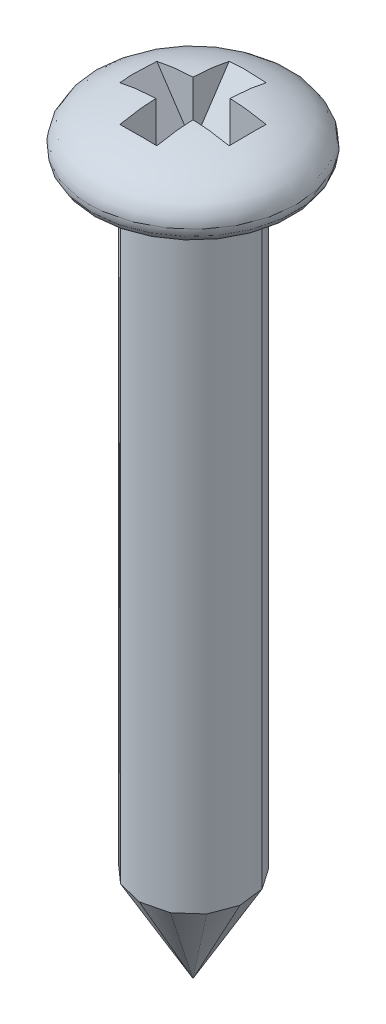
SolidWorks part; units mm, degrees
ref_plane "Plan de face" through (0, 0, 0) normal (0, 0, 1) x (1, 0, 0)
ref_plane "Plan de dessus" through (0, 0, 0) normal (0, 1, 0) x (1, 0, 0)
ref_plane "Plan de droite" through (0, 0, 0) normal (1, 0, 0) x (0, 0, -1)
ref_plane "Plan3" through (0, 6.4, 0) normal (0, 1, 0) x (-1, 0, 0)
sketch "Esquisse1" plane through (0, 6.4, 0) normal (0, 1, 0) x (-1, 0, 0)
  circle A0 centre (0, 0) radius 1.45
extrude "Extrusion1" add sketch "Esquisse1" against normal blind 19
sketch "Esquisse2" plane through (0, 0, 0) normal (0, 0, 1) x (1, 0, 0)
  line L0 (-3.5764, 6.4) -> (3.9855, 6.4) construction
  line L1 (0, 8.9067) -> (0, 4.7448) construction
  line L2 (-2.6992, 8) -> (4.0303, 8) construction
  line L3 (-2.8, 8.6386) -> (-2.8, 5.3938) construction
  line L4 (0, 6.4) -> (-2.3, 6.4)
  line L5 (0, 8) -> (0, 6.4)
  arc A0 (-2.3, 6.4) -> (-2.8, 6.9001) centre (-2.3, 6.9) cw
  spline S0 degree 3 poles (-2.8, 6.9001) (-2.802, 7.3106) (-1.7042, 7.9956) (-0.6729, 7.9983) (0, 8) knots 0 0 0 0 0.347597 1 1 1 1
  point P15 (-2.8, 6.4)
  point P18 (-2.8, 8)
  point P21 (0, 6.4)
  dimension "D1" = 0.5
revolve "Révolution1" add sketch "Esquisse2" angle 360 about L1
sketch "Esquisse3" plane through (0, 0, 0) normal (0, 0, 1) x (1, 0, 0)
  line L0 (0, 9.9885) -> (0, 5.1977) construction
  line L1 (-3.3122, 6.4) -> (4.0377, 6.4) construction
  line L2 (-3.6691, 0) -> (6.2564, 0) construction
  line L3 (-1.5, 8.9361) -> (-1.5, 5.7428) construction
  line L4 (-0.5, 7.218) -> (-0.5, 5.7428) construction
  line L5 (0, 8.589) -> (-1.5, 8.3981)
  line L6 (-2.5295, 7.9) -> (1.4809, 7.9) construction
  line L7 (-1.5, 8.3981) -> (-1.5, 7.9)
  line L8 (-1.5, 7.9) -> (-0.5, 6.4)
  line L9 (-0.5, 6.4) -> (0.5, 6.4)
  line L10 (1.5, 7.9) -> (0.5, 6.4)
  line L11 (1.5, 8.3981) -> (1.5, 7.9)
  line L12 (0, 8.589) -> (1.5, 8.3981)
  point P19 (0, 6.4)
extrude "Enlèv. mat.-Extru.1" cut sketch "Esquisse3" against normal mid plane 1
pattern_circular "Répétition circulaire1" count 2 every 90 about axis through (0, 0, 0) along (0, 1, 0) of "Enlèv. mat.-Extru.1"
chamfer "Chanfrein1" distance 1.44 distance2 2.5 1 edges at (0, -12.6, 1.45)
